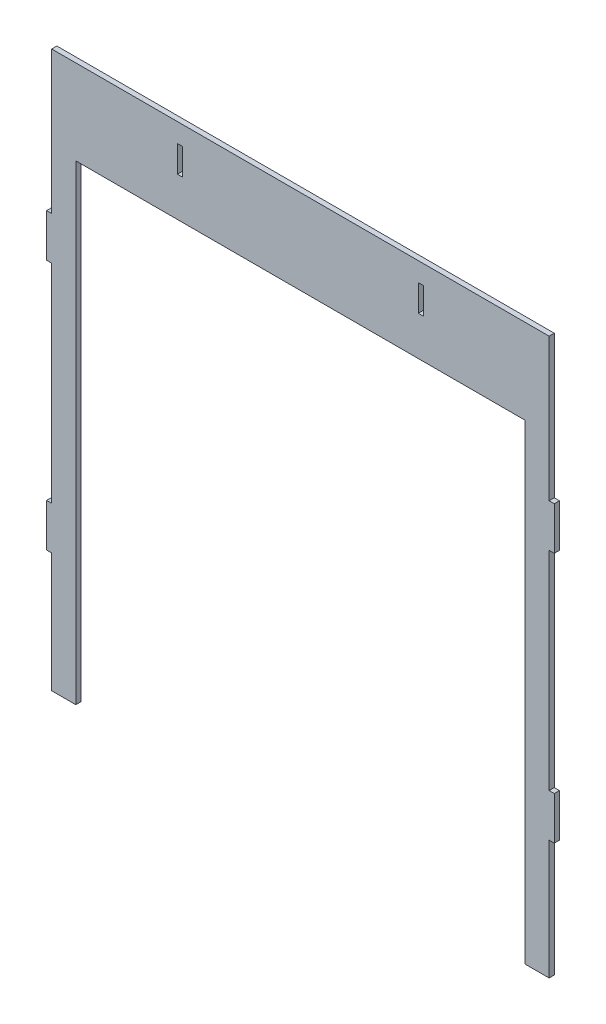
SolidWorks part; units mm, degrees
ref_plane "Front Plane" through (0, 0, 0) normal (0, 0, 1) x (1, 0, 0)
ref_plane "Top Plane" through (0, 0, 0) normal (0, 1, 0) x (1, 0, 0)
ref_plane "Right Plane" through (0, 0, 0) normal (1, 0, 0) x (0, 0, -1)
sketch "Sketch1" plane through (0, 0, 0) normal (0, 0, 1) x (1, 0, 0)
  line L0 (0, 61.1688) -> (1.524, 61.1688)
  line L1 (1.524, 61.1688) -> (1.524, 48.4688)
  line L2 (1.524, 48.4688) -> (0, 48.4688)
  line L3 (0, 48.4688) -> (0, 13.1989)
  line L4 (0, 13.1989) -> (-7.1195, 13.1989)
  line L5 (-7.1195, 13.1989) -> (-7.1195, 152.3874)
  line L6 (0, 61.1688) -> (0, 122.6306)
  line L7 (0, 122.6306) -> (1.524, 122.6306)
  line L8 (1.524, 122.6306) -> (1.524, 135.3306)
  line L9 (1.524, 135.3306) -> (0, 135.3306)
  line L10 (0, 135.3306) -> (0, 177.4532)
  line L11 (-73.4926, 162.5765) -> (-73.4926, 278.2988) construction
  line L12 (0, 177.4532) -> (-146.9852, 177.4532)
  line L13 (-7.1195, 152.3874) -> (-139.8657, 152.3874)
  line L14 (-146.9852, 135.3306) -> (-146.9852, 177.4532)
  line L15 (-148.5092, 135.3306) -> (-146.9852, 135.3306)
  line L16 (-148.5092, 122.6306) -> (-148.5092, 135.3306)
  line L17 (-146.9852, 122.6306) -> (-148.5092, 122.6306)
  line L18 (-146.9852, 61.1688) -> (-146.9852, 122.6306)
  line L19 (-139.8657, 13.1989) -> (-139.8657, 152.3874)
  line L20 (-146.9852, 13.1989) -> (-139.8657, 13.1989)
  line L21 (-146.9852, 48.4688) -> (-146.9852, 13.1989)
  line L22 (-148.5092, 48.4688) -> (-146.9852, 48.4688)
  line L23 (-148.5092, 61.1688) -> (-148.5092, 48.4688)
  line L24 (-146.9852, 61.1688) -> (-148.5092, 61.1688)
  point P28 (-73.4926, 152.3874)
  point P29 (-73.4926, 177.4532)
extrude "Boss-Extrude1" add sketch "Sketch1" along normal blind 1.524
sketch "Sketch2" plane through (0, 0, 1.524) normal (0, 0, 1) x (1, 0, 0)
  line L0 (-73.4926, 177.4532) -> (-73.4926, 225.2778) construction
  line L1 (-37.1458, 171.8412) -> (-38.6698, 171.8412)
  line L2 (-37.1458, 171.8412) -> (-37.1458, 163.9763)
  line L3 (-37.1458, 163.9763) -> (-38.6698, 163.9763)
  line L4 (-38.6698, 171.8412) -> (-38.6698, 163.9763)
  line L6 (-108.3154, 171.8412) -> (-108.3154, 163.9763)
  line L7 (-109.8394, 163.9763) -> (-108.3154, 163.9763)
  line L8 (-109.8394, 171.8412) -> (-109.8394, 163.9763)
  line L9 (-109.8394, 171.8412) -> (-108.3154, 171.8412)
extrude "Cut-Extrude1" cut sketch "Sketch2" against normal blind 1.524
